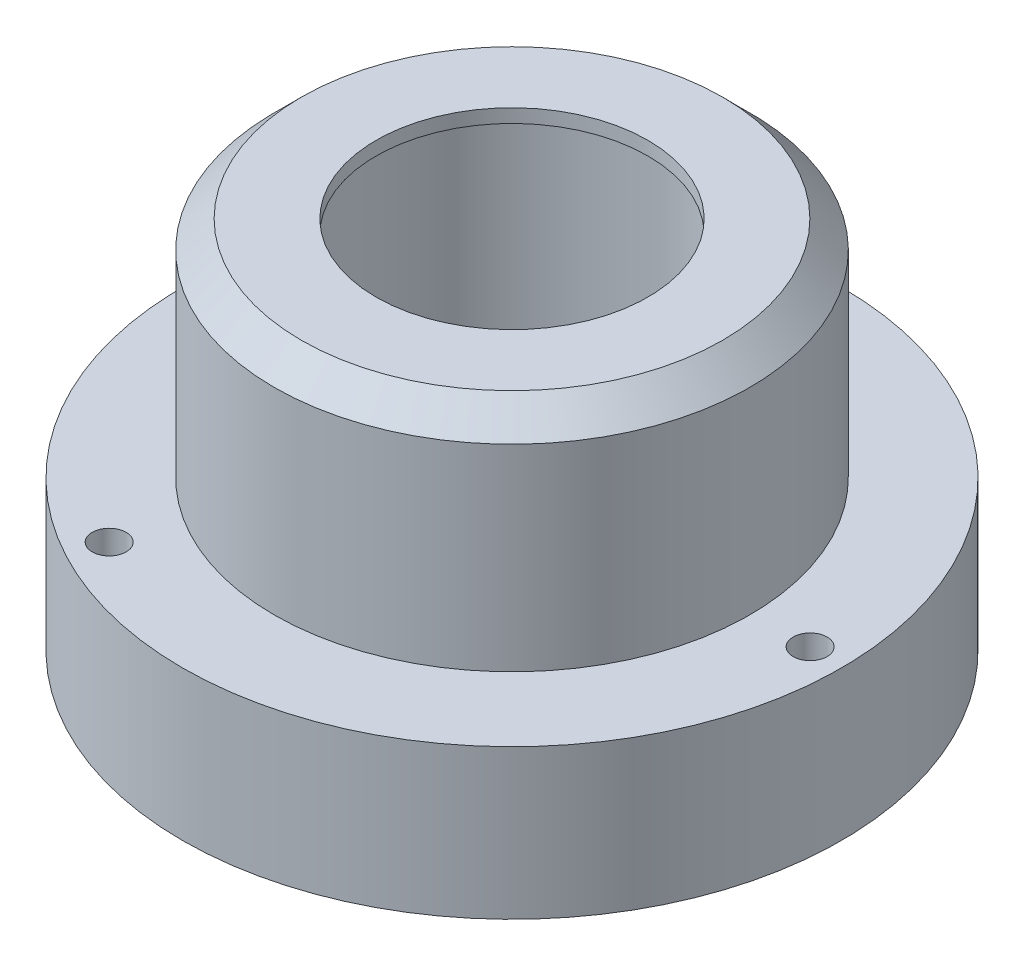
SolidWorks part; units mm, degrees
ref_plane "Plan de face" through (0, 0, 0) normal (0, 0, 1) x (1, 0, 0)
ref_plane "Plan de dessus" through (0, 0, 0) normal (0, 1, 0) x (1, 0, 0)
ref_plane "Plan de droite" through (0, 0, 0) normal (1, 0, 0) x (0, 0, -1)
sketch "Esquisse1" plane through (0, 0, 0) normal (0, 0, 1) x (1, 0, 0)
  line L0 (23.5, 0) -> (23.5, 53)
  line L1 (20, 55) -> (31, 55)
  line L2 (35, 51) -> (31, 55)
  line L4 (35, 51) -> (35, 22)
  line L5 (35, 22) -> (48.5, 22)
  line L6 (48.5, 22) -> (48.5, 0)
  line L7 (48.5, 0) -> (23.5, 0)
  line L8 (23.5, 53) -> (20, 53)
  line L9 (20, 53) -> (20, 55)
  line L10 (0, 45.2474) -> (0, -45.2474) construction
  dimension "D1" = 47
  dimension "D2" = 97
  dimension "D3" = 70
  dimension "D4" = 45
  dimension "D5" = 40
  dimension "D6" = 22
  dimension "D7" = 55
  dimension "D8" = 4
  dimension "D9" = 2
revolve "Révolution1" add sketch "Esquisse1" angle 360 about L10
hole_wizard "Trou taraudé M61" positions "Esquisse3D1" profile "Esquisse2" tap size "M6" standard "ISO"
sketch3d "Esquisse3D1"
  line L0 (0, 45.2474, 0) -> (0, -45.2474, 0) construction
  point P0 (43.4984, 22, -0.3779)
  dimension "D1" = 43.5
sketch "Esquisse2" plane through (43.4984, 22, -0.3779) normal (1, 0, 0) x (0, 0, 1)
  line L0 (0, 0) -> (0, 18.4434)
  line L1 (0, 18.4434) -> (2.5, 17)
  line L2 (2.5, 17) -> (2.5, 0)
  line L5 (2.5, 0) -> (0, 0)
  line L10 (0, 18.4434) -> (-2.5, 17) construction
  line L11 (0, -6.35) -> (0, 107.95) construction
  dimension "Diamètre du trou pour taraudage" = 5
  dimension "Profondeur du trou pour taraudage" = 17
  dimension "Angle de pointe" = 120
hole_wizard "Trou taraudé M41" positions "Esquisse3D2" profile "Esquisse3" tap size "M4" standard "ISO"
sketch3d "Esquisse3D2"
  point P0 (28, 0, 0)
  dimension "D1" = 28
sketch "Esquisse3" plane through (28, 0, 0) normal (1, 0, 0) x (0, 0, -1)
  line L0 (0, 0) -> (0, 12.4526)
  line L1 (0, 12.4526) -> (1.65, 11.5)
  line L2 (1.65, 11.5) -> (1.65, 0)
  line L5 (1.65, 0) -> (0, 0)
  line L10 (0, 12.4526) -> (-1.65, 11.5) construction
  line L11 (0, -6.35) -> (0, 107.95) construction
  dimension "Diamètre du trou pour taraudage" = 3.3
  dimension "Profondeur du trou pour taraudage" = 11.5
  dimension "Angle de pointe" = 120
hole_wizard "Trou taraudé M62" positions "Esquisse3D3" profile "Esquisse4" tap size "M6" standard "ISO"
sketch3d "Esquisse3D3"
  point P0 (-43, 0, 0)
  dimension "D1" = 43
sketch "Esquisse4" plane through (-43, 0, 0) normal (1, 0, 0) x (0, 0, -1)
  line L0 (0, 0) -> (0, 18.4434)
  line L1 (0, 18.4434) -> (2.5, 17)
  line L2 (2.5, 17) -> (2.5, 0)
  line L5 (2.5, 0) -> (0, 0)
  line L10 (0, 18.4434) -> (-2.5, 17) construction
  line L11 (0, -6.35) -> (0, 107.95) construction
  dimension "Diamètre du trou pour taraudage" = 5
  dimension "Profondeur du trou pour taraudage" = 17
  dimension "Angle de pointe" = 120
pattern_circular "Répétition circulaire1" count 3 every 120 about axis through (0, 0, 0) along (0, 1, 0) of "Trou taraudé M61", "Trou taraudé M41", "Trou taraudé M62"
